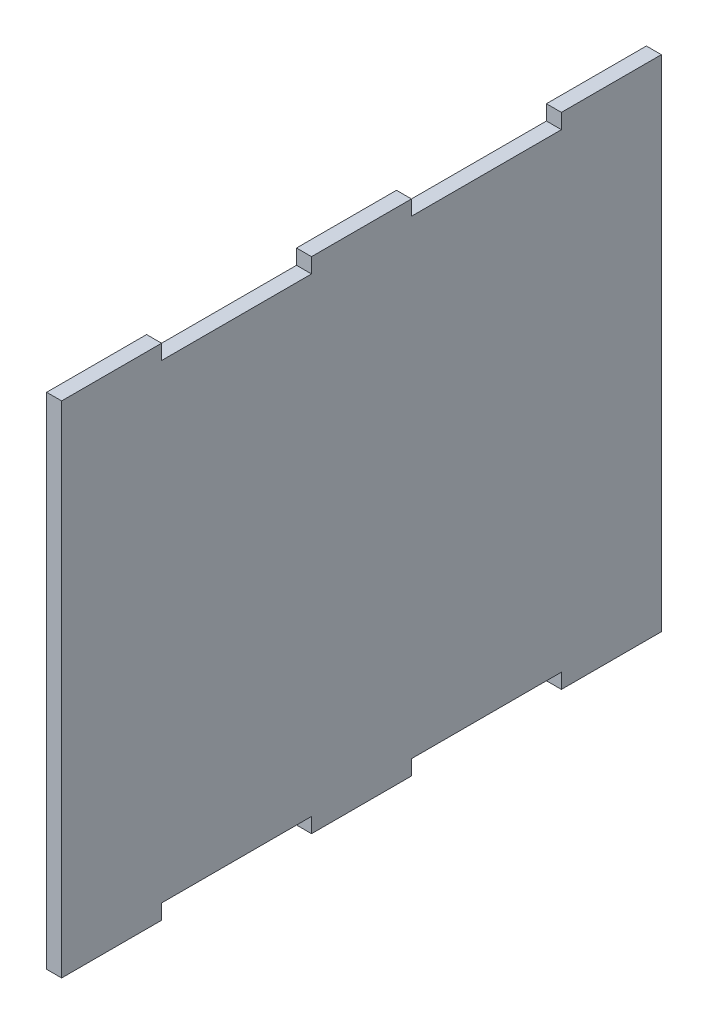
SolidWorks part; units mm, degrees
ref_plane "Front Plane" through (0, 0, 0) normal (0, 0, 1) x (1, 0, 0)
ref_plane "Top Plane" through (0, 0, 0) normal (0, 1, 0) x (1, 0, 0)
ref_plane "Right Plane" through (0, 0, 0) normal (1, 0, 0) x (0, 0, -1)
sketch "草图1" plane through (0, 0, 0) normal (1, 0, 0) x (0, 0, -1)
  line L0 (-64.4648, 26.9737) -> (-64.4648, -67.0263)
  line L1 (-64.4648, -67.0263) -> (55.5352, -67.0263)
  line L2 (55.5352, -67.0263) -> (55.5352, 26.9737)
  line L3 (55.5352, 26.9737) -> (-64.4648, 26.9737)
  dimension "D1" = 120
  dimension "D2" = 94
extrude "凸台-拉伸1" add sketch "草图1" along normal blind 3
sketch "草图2" plane through (3, 0, 0) normal (1, 0, 0) x (0, 0, -1)
  line L0 (-64.4648, -67.0263) -> (-64.4648, -70.0263)
  line L1 (-64.4648, -70.0263) -> (-44.4648, -70.0263)
  line L2 (-44.4648, -70.0263) -> (-44.4648, -67.0263)
  line L3 (-64.4648, -67.0263) -> (55.5352, -67.0263) construction
  line L4 (-44.4648, -67.0263) -> (-64.4648, -67.0263)
  line L5 (-14.4648, -67.0263) -> (-14.4648, -70.0263)
  line L6 (-14.4648, -70.0263) -> (5.5352, -70.0263)
  line L7 (5.5352, -70.0263) -> (5.5352, -67.0263)
  line L8 (5.5352, -67.0263) -> (-14.4648, -67.0263)
  line L9 (35.5352, -67.0263) -> (35.5352, -70.0263)
  line L10 (35.5352, -70.0263) -> (55.5352, -70.0263)
  line L11 (55.5352, -70.0263) -> (55.5352, -67.0263)
  line L12 (55.5352, -67.0263) -> (35.5352, -67.0263)
  line L13 (-64.4648, -20.0263) -> (55.5352, -20.0263) construction
  line L14 (-64.4648, 26.9737) -> (-64.4648, -67.0263) construction
  line L15 (55.5352, -67.0263) -> (55.5352, 26.9737) construction
  line L16 (55.5352, 26.9737) -> (35.5352, 26.9737)
  line L17 (55.5352, 29.9737) -> (55.5352, 26.9737)
  line L18 (35.5352, 29.9737) -> (55.5352, 29.9737)
  line L19 (35.5352, 26.9737) -> (35.5352, 29.9737)
  line L20 (5.5352, 26.9737) -> (-14.4648, 26.9737)
  line L21 (5.5352, 29.9737) -> (5.5352, 26.9737)
  line L22 (-14.4648, 29.9737) -> (5.5352, 29.9737)
  line L23 (-14.4648, 26.9737) -> (-14.4648, 29.9737)
  line L24 (-44.4648, 26.9737) -> (-64.4648, 26.9737)
  line L25 (-44.4648, 29.9737) -> (-44.4648, 26.9737)
  line L26 (-64.4648, 29.9737) -> (-44.4648, 29.9737)
  line L27 (-64.4648, 26.9737) -> (-64.4648, 29.9737)
  dimension "D1" = 3
  dimension "D2" = 3
  dimension "D3" = 3
  dimension "D4" = 20
  dimension "D5" = 30
  dimension "D6" = 20
  dimension "D7" = 30
extrude "凸台-拉伸2" add sketch "草图2" against normal blind 3
